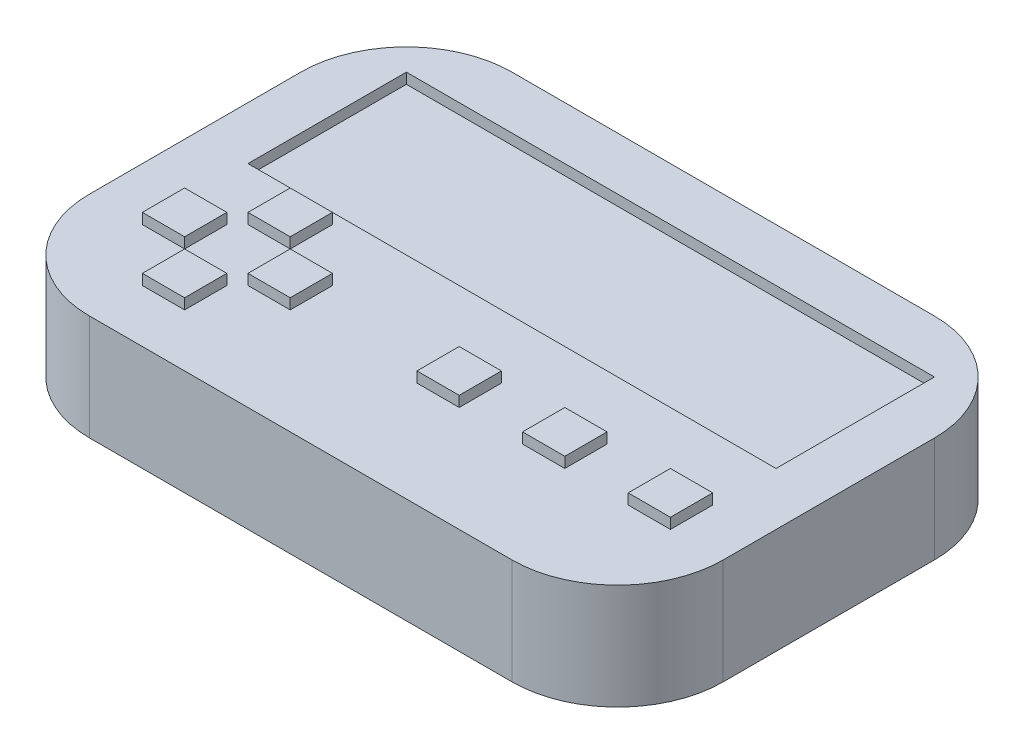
SolidWorks part; units mm, degrees
ref_plane "Front Plane" through (0, 0, 0) normal (0, 0, 1) x (1, 0, 0)
ref_plane "Top Plane" through (0, 0, 0) normal (0, 1, 0) x (1, 0, 0)
ref_plane "Right Plane" through (0, 0, 0) normal (1, 0, 0) x (0, 0, -1)
sketch "Sketch1" plane through (0, 0, 0) normal (0, 1, 0) x (1, 0, 0)
  line L1 (-76.2, 50.8) -> (76.2, 50.8)
  line L2 (-76.2, 50.8) -> (-76.2, -50.8)
  line L3 (-76.2, -50.8) -> (76.2, -50.8)
  line L4 (76.2, 50.8) -> (76.2, -50.8)
  line L5 (-76.2, 50.8) -> (76.2, -50.8) construction
  line L6 (-76.2, -50.8) -> (76.2, 50.8) construction
  point P0 (0, 0)
  dimension "D1" = 152.4
  dimension "D2" = 101.6
extrude "Boss-Extrude1" add sketch "Sketch1" along normal blind 25.4
sketch "Sketch2" plane through (0, 25.4, 0) normal (0, 1, 0) x (1, 0, 0)
  line L0 (76.2, 50.8) -> (-76.2, 50.8) construction
  line L1 (-63.5, 0) -> (63.5, 0)
  line L2 (-63.5, 0) -> (-63.5, 38.1)
  line L3 (-63.5, 38.1) -> (63.5, 38.1)
  line L4 (63.5, 0) -> (63.5, 38.1)
  line L5 (-63.5, 0) -> (63.5, 38.1) construction
  line L6 (-63.5, 38.1) -> (63.5, 0) construction
  point P0 (0, 19.05)
  point P5 (0, 0)
  dimension "D1" = 127
  dimension "D2" = 38.1
  dimension "D3" = 12.7
extrude "Cut-Extrude1" cut sketch "Sketch2" against normal blind 2.54
sketch "Sketch3" plane through (0, 25.4, 0) normal (0, 1, 0) x (1, 0, 0)
  line L0 (-58.42, -20.32) -> (-33.02, -20.32) construction
  line L1 (-50.8, -2.54) -> (-40.64, -2.54)
  line L2 (-50.8, -2.54) -> (-50.8, -12.7)
  line L3 (-50.8, -12.7) -> (-40.64, -12.7)
  line L4 (-40.64, -2.54) -> (-40.64, -12.7)
  line L5 (-50.8, -2.54) -> (-40.64, -12.7) construction
  line L6 (-50.8, -12.7) -> (-40.64, -2.54) construction
  line L7 (-50.8, -38.1) -> (-40.64, -38.1)
  line L8 (-50.8, -38.1) -> (-50.8, -27.94)
  line L9 (-50.8, -27.94) -> (-40.64, -27.94)
  line L10 (-40.64, -38.1) -> (-40.64, -27.94)
  line L11 (-50.8, -38.1) -> (-40.64, -27.94) construction
  line L12 (-50.8, -27.94) -> (-40.64, -38.1) construction
  line L13 (-27.94, -25.4) -> (-38.1, -25.4)
  line L14 (-27.94, -25.4) -> (-27.94, -15.24)
  line L15 (-27.94, -15.24) -> (-38.1, -15.24)
  line L16 (-38.1, -25.4) -> (-38.1, -15.24)
  line L17 (-27.94, -25.4) -> (-38.1, -15.24) construction
  line L18 (-27.94, -15.24) -> (-38.1, -25.4) construction
  line L19 (-63.5, -15.24) -> (-53.34, -15.24)
  line L20 (-63.5, -15.24) -> (-63.5, -25.4)
  line L21 (-63.5, -25.4) -> (-53.34, -25.4)
  line L22 (-53.34, -15.24) -> (-53.34, -25.4)
  line L23 (-63.5, -15.24) -> (-53.34, -25.4) construction
  line L24 (-63.5, -25.4) -> (-53.34, -15.24) construction
  line L25 (-45.72, -7.62) -> (-45.72, -33.02) construction
  line L26 (-76.2, -50.8) -> (76.2, -50.8) construction
  line L27 (-76.2, 50.8) -> (-76.2, -50.8) construction
  point P0 (-45.72, -7.62)
  point P5 (-45.72, -33.02)
  point P10 (-33.02, -20.32)
  point P15 (-58.42, -20.32)
  point P24 (-45.72, -20.32)
  point P25 (-45.72, -20.32)
  point P26 (-77.1768, -12.2642)
  point P27 (-67.5806, -23.7802)
  point P28 (-47.1506, -10.9446)
  point P29 (-47.1264, -28.8817)
  dimension "D1" = 10.16
  dimension "D2" = 25.4
  dimension "D3" = 12.7
  dimension "D4" = 12.7
extrude "Boss-Extrude2" add sketch "Sketch3" along normal blind 2.54
sketch "Sketch4" plane through (0, 25.4, 0) normal (0, 1, 0) x (1, 0, 0)
  line L0 (27.94, -15.24) -> (38.1, -15.24)
  line L1 (2.54, -15.24) -> (12.7, -15.24)
  line L2 (2.54, -15.24) -> (2.54, -25.4)
  line L3 (2.54, -25.4) -> (12.7, -25.4)
  line L4 (12.7, -15.24) -> (12.7, -25.4)
  line L5 (2.54, -15.24) -> (12.7, -25.4) construction
  line L6 (2.54, -25.4) -> (12.7, -15.24) construction
  line L7 (27.94, -15.24) -> (27.94, -25.4)
  line L8 (27.94, -25.4) -> (38.1, -25.4)
  line L9 (38.1, -15.24) -> (38.1, -25.4)
  line L10 (27.94, -15.24) -> (38.1, -25.4) construction
  line L11 (27.94, -25.4) -> (38.1, -15.24) construction
  line L12 (53.34, -15.24) -> (63.5, -15.24)
  line L13 (53.34, -15.24) -> (53.34, -25.4)
  line L14 (53.34, -25.4) -> (63.5, -25.4)
  line L15 (63.5, -15.24) -> (63.5, -25.4)
  line L16 (53.34, -15.24) -> (63.5, -25.4) construction
  line L17 (53.34, -25.4) -> (63.5, -15.24) construction
  line L18 (-76.2, -50.8) -> (76.2, -50.8) construction
  line L19 (76.2, -50.8) -> (76.2, 50.8) construction
  line L20 (7.62, -20.32) -> (33.02, -20.32) construction
  line L21 (33.02, -20.32) -> (58.42, -20.32) construction
  point P0 (7.62, -20.32)
  point P6 (33.02, -20.32)
  point P11 (58.42, -20.32)
  dimension "D2" = 10.16
  dimension "D3" = 10.16
  dimension "D4" = 25.4
  dimension "D5" = 12.7
  dimension "D6" = 25.4
  dimension "D1" = 3
extrude "Boss-Extrude3" add sketch "Sketch4" along normal blind 2.54
fillet "Fillet1" radius 25.4 4 edges at (76.2, 12.7, 50.8) (76.2, 12.7, -50.8) (-76.2, 12.7, -50.8) (-76.2, 12.7, 50.8)
